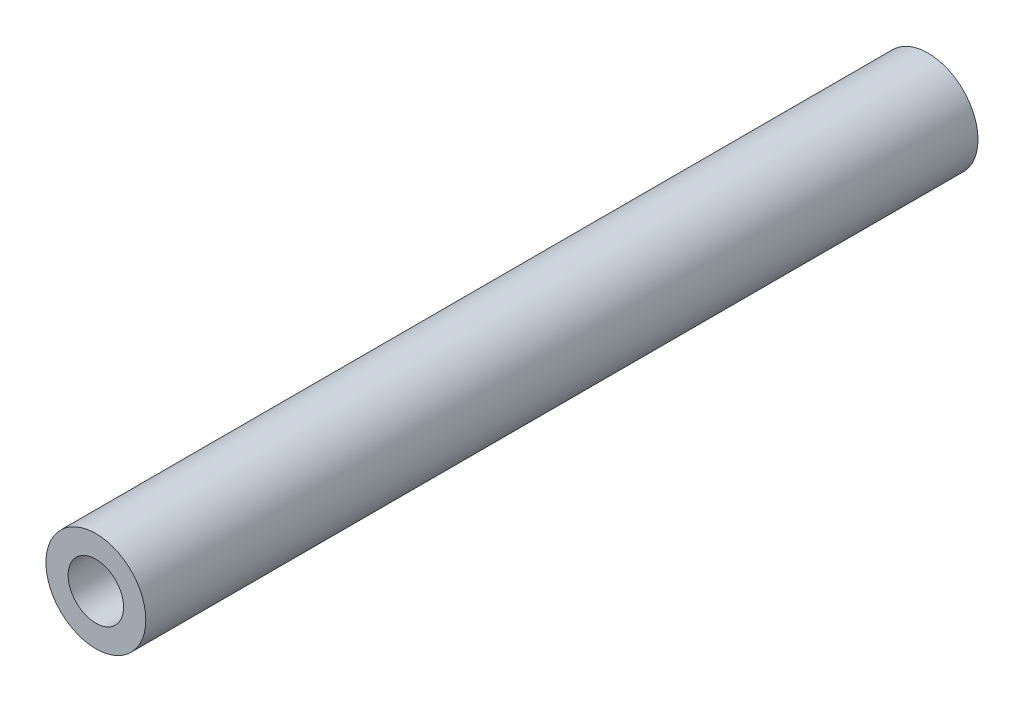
SolidWorks part; units mm, degrees
ref_plane "Front Plane" through (0, 0, 0) normal (0, 0, 1) x (1, 0, 0)
ref_plane "Top Plane" through (0, 0, 0) normal (0, 1, 0) x (1, 0, 0)
ref_plane "Right Plane" through (0, 0, 0) normal (1, 0, 0) x (0, 0, -1)
sketch "Sketch1" plane through (0, 0, 0) normal (0, 0, 1) x (1, 0, 0)
  circle A0 centre (0, 0) radius 22.5
  dimension "D1" = 45
extrude "Boss-Extrude1" add sketch "Sketch1" along normal blind 375
sketch "Sketch2" plane through (0, 0, 375) normal (0, 0, 1) x (1, 0, 0)
  circle A0 centre (0, 0) radius 12.5
  dimension "D1" = 25
extrude "Cut-Extrude1" cut sketch "Sketch2" against normal offset from surface (370 mm away) 5
